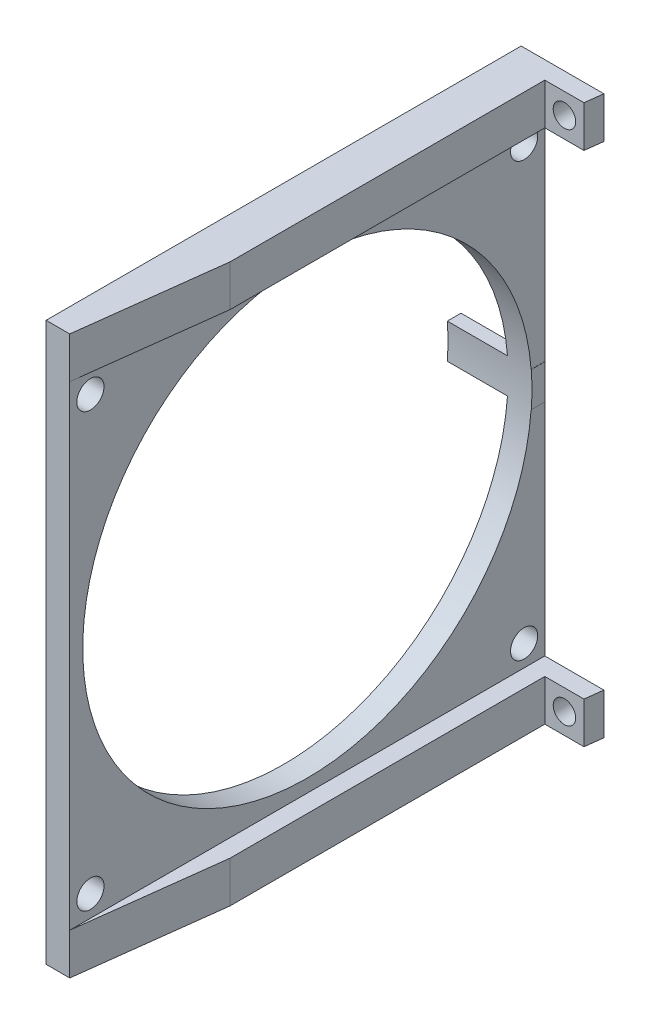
SolidWorks part; units mm, degrees
ref_plane "Front Plane" through (0, 0, 0) normal (0, 0, 1) x (1, 0, 0)
ref_plane "Top Plane" through (0, 0, 0) normal (0, 1, 0) x (1, 0, 0)
ref_plane "Right Plane" through (0, 0, 0) normal (1, 0, 0) x (0, 0, -1)
sketch "Sketch2" plane through (0, 0, 0) normal (0, 1, 0) x (1, 0, 0)
  line L1 (0, 0) -> (4, 0)
  line L2 (0, 0) -> (0, 80.4)
  line L3 (0, 80.4) -> (4, 80.4)
  line L4 (4, 0) -> (4, 80.4)
  dimension "D1" = 80.4
  dimension "D2" = 4
extrude "Boss-Extrude1" add sketch "Sketch2" along normal blind 80.4
sketch "Sketch11" plane through (0, 0, -80.4) normal (0, 0, -1) x (-1, 0, 0)
  line L0 (0, 80.4) -> (0, 0) construction
  line L5 (0, 37.2535) -> (0, 43.1465) construction
  line L6 (-4.0246, 40.2) -> (4.0246, 40.2) construction
  line L8 (-4.0246, 43.1465) -> (10.1883, 43.1465)
  line L9 (-4.0246, 43.1465) -> (-4.0246, 37.2535)
  line L10 (-4.0246, 37.2535) -> (10.1883, 37.2535)
  line L11 (10.1883, 43.1465) -> (10.1883, 37.2535)
  point P0 (0, 40.2)
extrude "Boss-Extrude4" add sketch "Sketch11" against normal blind 4 contours L9 L8 L11 L10
sketch "Sketch3" plane through (4, 0, 0) normal (1, 0, 0) x (0, 0, -1)
  line L0 (40.2, 80.4) -> (40.2, 0) construction
  line L2 (0, 80.4) -> (80.4, 80.4) construction
  line L3 (0, 0) -> (80.4, 0) construction
  line L4 (0, 40.2) -> (80.4, 40.2) construction
  line L5 (0, 80.4) -> (0, 0) construction
  line L6 (80.4, 80.4) -> (80.4, 43.1465) construction
  circle A0 centre (3.5, 76.8) radius 2.3
  circle A1 centre (3.5, 3.6) radius 2.3
  circle A2 centre (76.9, 3.6) radius 2.3
  circle A3 centre (76.9, 76.8) radius 2.3
  circle A4 centre (40.2, 40.2) radius 38
  dimension "D1" = 4.6
sketch "Sketch4" plane through (0, 0, 0) normal (-1, 0, 0) x (0, 0, 1)
  line L1 (-80.4, 0) -> (0, 0)
  line L2 (-80.4, 0) -> (-80.4, -7)
  line L3 (-80.4, -7) -> (0, -7)
  line L4 (0, 0) -> (0, -7)
  line L5 (-80.4, 80.4) -> (0, 80.4)
  line L6 (-80.4, 80.4) -> (-80.4, 87.4)
  line L7 (-80.4, 87.4) -> (0, 87.4)
  line L8 (0, 80.4) -> (0, 87.4)
extrude "Cut-Extrude3" cut sketch "Sketch3" against normal blind 24 and the other way blind 4
extrude "Boss-Extrude3" add sketch "Sketch4" against normal blind 14
sketch "Sketch8" plane through (0, 87.4, 0) normal (0, 1, 0) x (1, 0, 0)
  line L0 (4, 0) -> (14, 0)
  line L1 (4, 0) -> (14, 80.4)
  line L2 (14, 0) -> (14, 80.4)
extrude "Cut-Extrude5" cut sketch "Sketch8" against normal blind 95
sketch "Sketch9" plane through (0, 0, -80.4) normal (0, 0, -1) x (-1, 0, 0)
  line L0 (10.1883, 40.2) -> (-19.4424, 40.2) construction
  line L2 (10.1883, 43.1465) -> (10.1883, 37.2535) construction
  circle A0 centre (-10.3209, 83.9) radius 1.9
  circle A2 centre (-10.3209, -3.5) radius 1.9
extrude "Cut-Extrude6" cut sketch "Sketch9" against normal blind 95
sketch "Sketch10" plane through (0, 87.4, 0) normal (0, 1, 0) x (1, 0, 0)
  line L4 (14, 80.4) -> (4, 0) construction
  line L6 (7, 77.4) -> (13.6269, 77.4)
  line L7 (13.6269, 77.4) -> (7, 24.12)
  line L8 (7, 77.4) -> (7, 24.12)
extrude "Cut-Extrude7" cut sketch "Sketch10" against normal blind 95
sketch "Sketch12" plane through (0, 0, -80.4) normal (0, 0, -1) x (-1, 0, 0)
  circle A0 centre (6.0814, 40.2) radius 1.9
  dimension "D1" = 3.8
equation "\"D2@Sketch4\"=\"D1@Sketch4\""
